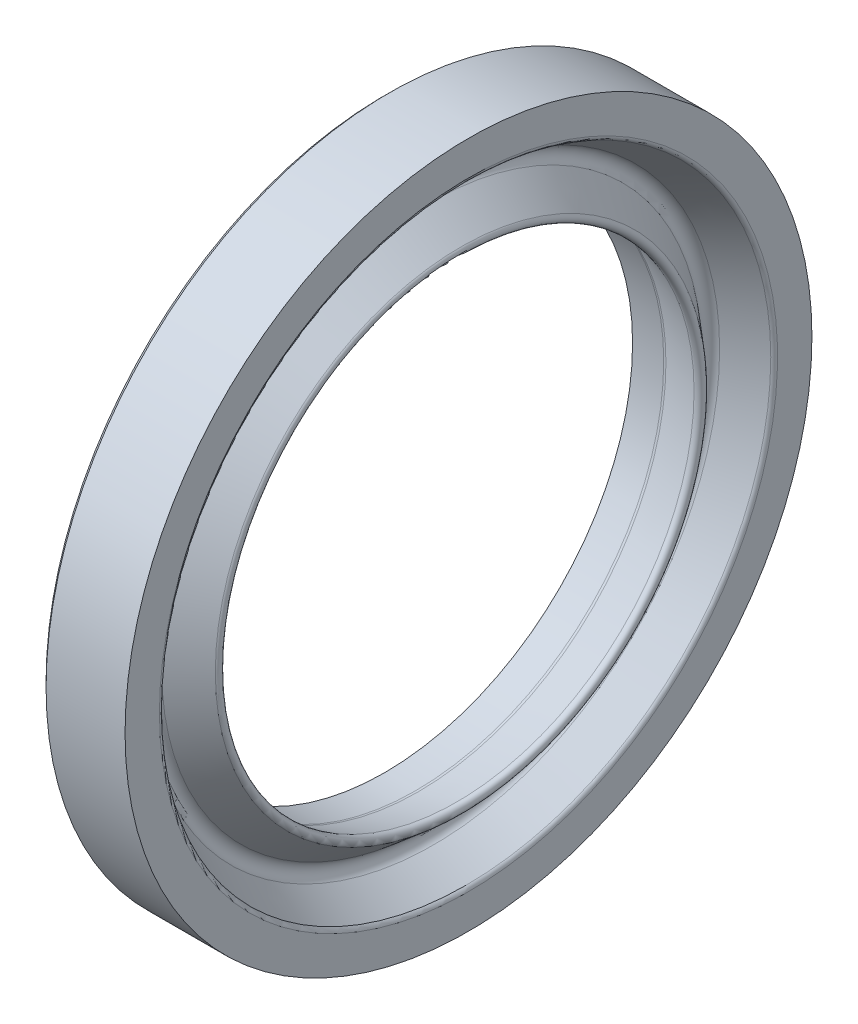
SolidWorks part; units mm, degrees
ref_plane "Plan de face" through (0, 0, 0) normal (0, 0, 1) x (1, 0, 0)
ref_plane "Plan de dessus" through (0, 0, 0) normal (0, 1, 0) x (1, 0, 0)
ref_plane "Plan de droite" through (0, 0, 0) normal (1, 0, 0) x (0, 0, -1)
sketch "Esquisse1" plane through (0, 0, 0) normal (0, 0, 1) x (1, 0, 0)
  line L0 (-33.8963, 0) -> (38.2757, 0) construction
  line L1 (0, 0) -> (0, -18.7589) construction
  line L8 (0.65, -45) -> (0, -44.35)
  line L9 (0, -44.35) -> (0, -32.5)
  line L10 (11, -45) -> (0.65, -45)
  line L11 (11, -45) -> (11, -40.4954)
  line L12 (10.672, -39.9339) -> (6.3874, -37.5179)
  line L13 (6.1903, -35.3897) -> (10.0108, -32.1839)
  line L14 (4.4153, -32.4557) -> (9.45, -31.1067)
  line L15 (0, -32.5) -> (4.0789, -32.5)
  arc A4 (11, -40.4954) -> (10.672, -39.9339) centre (10.3554, -40.4954) ccw
  arc A5 (4.0789, -32.5) -> (4.4153, -32.4557) centre (4.0789, -31.2) ccw
  arc A6 (6.1903, -35.3897) -> (6.3874, -37.5179) centre (7.0259, -36.3855) ccw
  arc A7 (10.0108, -32.1839) -> (9.45, -31.1067) centre (9.611, -31.7074) ccw
  dimension "D11" = 32.5
  dimension "D13" = 90
  dimension "D2" = 0.65
  dimension "D3" = 0.65
  dimension "D4" = 11
revolve "Révolution1" add sketch "Esquisse1" angle 360 about L0
